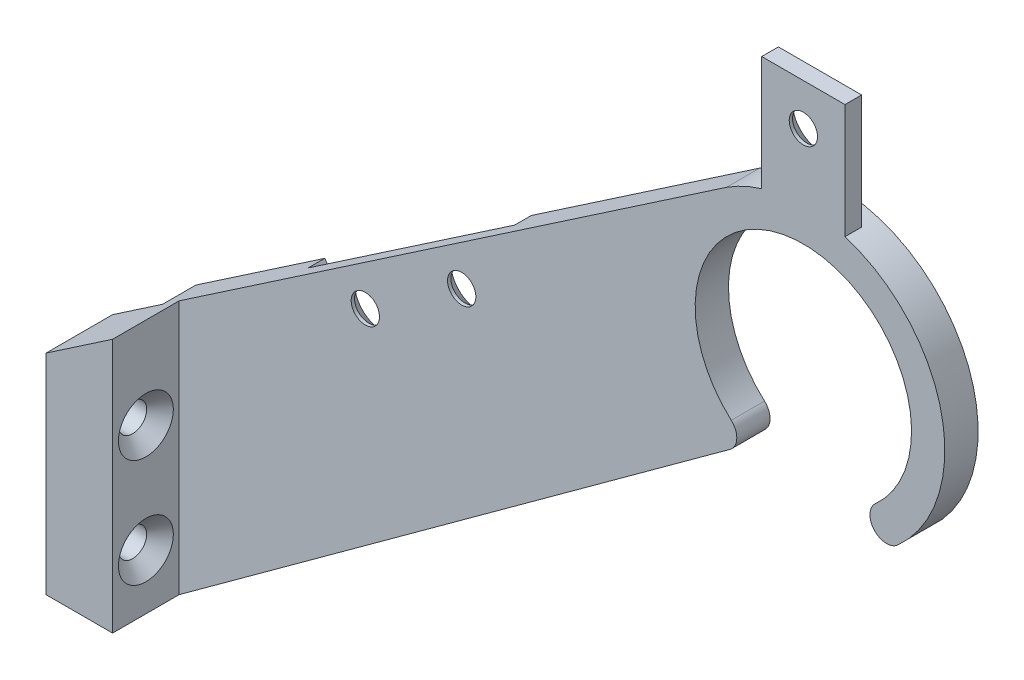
SolidWorks part; units mm, degrees
ref_plane "前视基准面" through (0, 0, 0) normal (0, 0, 1) x (1, 0, 0)
ref_plane "上视基准面" through (0, 0, 0) normal (0, 1, 0) x (1, 0, 0)
ref_plane "右视基准面" through (0, 0, 0) normal (1, 0, 0) x (0, 0, -1)
other "Configuration Table"
sketch "草图1" plane through (0, 0, 0) normal (0, 0, 1) x (1, 0, 0)
  line L0 (0, 0) -> (30.7698, 0) construction
  line L1 (0, 0) -> (0, 20.1819) construction
  line L4 (-6, 12.6394) -> (-6, -12.5)
  line L5 (-6, -12.5) -> (2, -12.5)
  line L10 (-6, 12.6394) -> (67.7706, 62.7765)
  line L11 (2, -12.5) -> (68.1775, 35.703)
  arc A1 (85.6667, 38.8104) -> (68.3333, 38.8104) centre (77, 48.5) ccw
  arc A2 (85.6667, 38.8104) -> (88.3333, 35.8289) centre (87, 37.3197) ccw
  arc A3 (68.1775, 35.703) -> (68.3333, 38.8104) centre (67, 37.3197) ccw
  arc A4 (88.3333, 35.8289) -> (67.7706, 62.7765) centre (77, 48.5) ccw
  point P1 (0, 0)
  point P9 (0, 0)
  dimension "D4" = 26
  dimension "D1" = 8
  dimension "D2" = 83
extrude "凸台-拉伸1" add sketch "草图1" along normal blind 4
sketch "草图2" plane through (0, 0, 4) normal (0, 0, 1) x (1, 0, 0)
  line L0 (2, 12.6394) -> (2, 18.0764)
  line L2 (-6, 12.6394) -> (-6, -12.5)
  line L3 (-6, -12.5) -> (2, -12.5)
  line L4 (2, 12.6394) -> (2, -12.5)
  line L5 (67.7706, 62.7765) -> (-6, 12.6394) construction
  line L6 (-6, 12.6394) -> (2, 18.0764)
extrude "凸台-拉伸2" add sketch "草图2" along normal blind 8
hole_wizard "M3 十字槽沉头木螺钉的锥形沉头孔1" positions "草图3" profile "草图4" countersink size "M3" standard "GB"
sketch "草图3" plane through (2, 0, 0) normal (1, 0, 0) x (0, 0, -1)
  line L0 (-4, -12.5) -> (-4, 18.0764) construction
  line L1 (-4, -12.5) -> (-4, 35.703) construction
  line L3 (-12, 12.6394) -> (0, 12.6394) construction
  point P0 (-8, 7.1394)
  point P2 (-8, -5.8606)
  dimension "D1" = 4
  dimension "D2" = 4
  dimension "D3" = 5.5
  dimension "D4" = 13
sketch "草图4" plane through (2, 7.1394, 8) normal (0, 1, 0) x (0, 0, -1)
  line L0 (0, 0) -> (0, 8)
  line L1 (0, 8) -> (1.7, 8)
  line L2 (1.7, 8) -> (1.7, 1.6)
  line L3 (1.7, 1.6) -> (3.3, 0)
  line L5 (3.3, 0) -> (0, 0)
  line L6 (-1.7, 1.6) -> (-3.3, 0) construction
  line L11 (0, -6.35) -> (0, 107.95) construction
  dimension "通孔孔直径" = 3.4
  dimension "通孔孔深度" = 8
  dimension "近端锥形沉头孔直径" = 6.6
  dimension "近端锥形沉头孔角度" = 90
sketch "草图5" plane through (0, 0, 0) normal (0, 0, -1) x (-1, 0, 0)
  line L0 (-40.3152, 44.1168) -> (-15.5032, 27.2537)
  line L1 (-67.7706, 62.7765) -> (6, 12.6394) construction
  line L2 (-15.5032, 27.2537) -> (-20, 20.6371)
  line L3 (-20, 20.6371) -> (-44.812, 37.5003)
  line L4 (-44.812, 37.5003) -> (-40.3152, 44.1168)
  line L5 (6, 12.6394) -> (6, -12.5) construction
  dimension "D1" = 30
  dimension "D2" = 8
  dimension "D3" = 26
extrude "切除-拉伸1" cut sketch "草图5" against normal blind 2
hole_wizard "M3 十字槽沉头木螺钉的锥形沉头孔2" positions "草图6" profile "草图7" countersink size "M3" standard "GB"
sketch "草图6" plane through (0, 0, 2) normal (0, 0, -1) x (-1, 0, 0)
  line L0 (-40.3152, 44.1168) -> (-44.812, 37.5003) construction
  line L1 (-20, 20.6371) -> (-15.5032, 27.2537) construction
  line L2 (-15.5032, 27.2537) -> (-40.3152, 44.1168) construction
  point P0 (-35.947, 36.3117)
  point P2 (-24.3681, 28.4422)
  dimension "D1" = 8
  dimension "D2" = 8
  dimension "D3" = 4
  dimension "D4" = 4
sketch "草图7" plane through (35.947, 36.3117, 2) normal (1, 0, 0) x (0, 1, 0)
  line L0 (0, 0) -> (0, 10)
  line L1 (0, 10) -> (1.7, 10)
  line L2 (1.7, 10) -> (1.7, 1.6)
  line L3 (1.7, 1.6) -> (3.3, 0)
  line L5 (3.3, 0) -> (0, 0)
  line L6 (-1.7, 1.6) -> (-3.3, 0) construction
  line L11 (0, -6.35) -> (0, 107.95) construction
  dimension "通孔孔直径" = 3.4
  dimension "通孔孔深度" = 10
  dimension "近端锥形沉头孔直径" = 6.6
  dimension "近端锥形沉头孔角度" = 90
sketch "草图8" plane through (0, 0, 0) normal (0, 0, -1) x (-1, 0, 0)
  line L2 (-82, 64.743) -> (-82, 78.5)
  line L3 (-82, 78.5) -> (-72, 78.5)
  line L4 (-72, 64.743) -> (-72, 78.5)
  line L5 (-77, 48.5) -> (-72, 78.5) construction
  line L6 (-82, 78.5) -> (-77, 48.5) construction
  arc A1 (-72, 64.743) -> (-82, 64.743) centre (-77, 48.5) ccw
  point P0 (-77, 48.5)
  dimension "D1" = 10
  dimension "D2" = 5
extrude "凸台-拉伸3" add sketch "草图8" along normal blind 2 from offset 4
hole_wizard "M3 十字槽沉头木螺钉的锥形沉头孔3" positions "草图9" profile "草图10" countersink size "M3" standard "GB"
sketch "草图9" plane through (0, 0, 2) normal (0, 0, -1) x (-1, 0, 0)
  line L0 (-72, 78.5) -> (-82, 78.5) construction
  line L1 (-82, 78.5) -> (-82, 64.7481) construction
  point P0 (-77, 73.5)
  dimension "D1" = 5
  dimension "D2" = 5
sketch "草图10" plane through (77, 73.5, 2) normal (1, 0, 0) x (0, 1, 0)
  line L0 (0, 0) -> (0, 10)
  line L1 (0, 10) -> (1.7, 10)
  line L2 (1.7, 10) -> (1.7, 1.6)
  line L3 (1.7, 1.6) -> (3.3, 0)
  line L5 (3.3, 0) -> (0, 0)
  line L6 (-1.7, 1.6) -> (-3.3, 0) construction
  line L11 (0, -6.35) -> (0, 107.95) construction
  dimension "通孔孔直径" = 3.4
  dimension "通孔孔深度" = 10
  dimension "近端锥形沉头孔直径" = 6.6
  dimension "近端锥形沉头孔角度" = 90
sketch "草图11" plane through (0, 0, 0) normal (0, 0, -1) x (-1, 0, 0)
  line L0 (-15.5032, 27.2537) -> (6, 12.6394) construction
  line L1 (0, 16.7172) -> (12.9802, 16.7172)
  line L2 (0, 16.7172) -> (0, -23.2828)
  line L3 (0, -23.2828) -> (12.9802, -23.2828)
  line L4 (12.9802, 16.7172) -> (12.9802, -23.2828)
  line L5 (6, 12.6394) -> (6, -12.5) construction
  dimension "D1" = 6
  dimension "D2" = 40
extrude "切除-拉伸2" cut sketch "草图11" against normal blind 4
